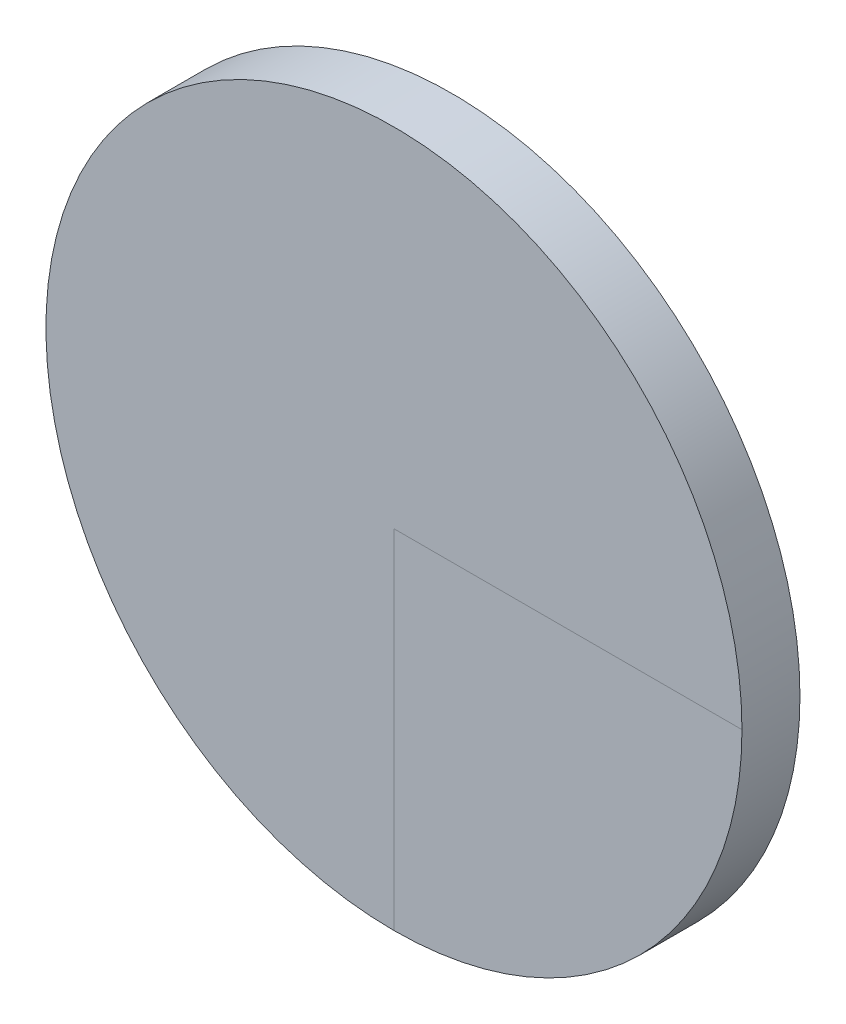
SolidWorks part; units mm, degrees
ref_plane "Front Plane" through (0, 0, 0) normal (0, 0, 1) x (1, 0, 0)
ref_plane "Top Plane" through (0, 0, 0) normal (0, 1, 0) x (1, 0, 0)
ref_plane "Right Plane" through (0, 0, 0) normal (1, 0, 0) x (0, 0, -1)
sketch "Sketch1" plane through (0, 0, 0) normal (0, 0, 1) x (1, 0, 0)
  circle A0 centre (0, 0) radius 60
  dimension "D1" = 120
extrude "Extrude1" add sketch "Sketch1" along normal blind 10
sketch "Sketch2" plane through (0, 0, 10) normal (0, 0, 1) x (1, 0, 0)
  line L0 (0, 0) -> (60, 0)
  line L1 (0, 0) -> (0, -60)
  circle A0 centre (0, 0) radius 60 construction
  arc A1 (0, -60) -> (60, 0) centre (0, 0) ccw
